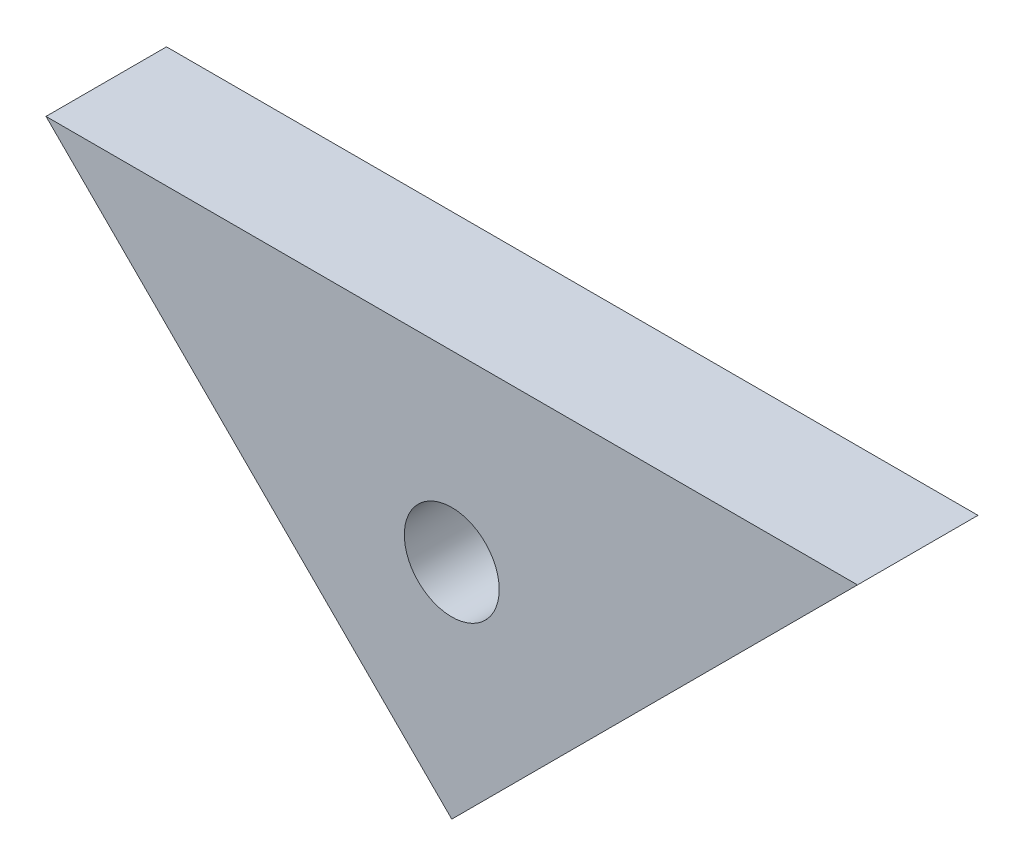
SolidWorks part; units mm, degrees
ref_plane "Front Plane" through (0, 0, 0) normal (0, 0, 1) x (1, 0, 0)
ref_plane "Top Plane" through (0, 0, 0) normal (0, 1, 0) x (1, 0, 0)
ref_plane "Right Plane" through (0, 0, 0) normal (1, 0, 0) x (0, 0, -1)
sketch "Sketch2" plane through (0, 0, 0) normal (0, 0, 1) x (1, 0, 0)
  line L0 (0, 0) -> (13.4704, 13.4704)
  line L1 (0, 0) -> (-13.4704, 13.4704)
  line L2 (-13.4704, 13.4704) -> (13.4704, 13.4704)
extrude "Boss-Extrude1" add sketch "Sketch2" along normal blind 4 contours L1 L2 L0
sketch "Sketch4" plane through (0, 0, 4) normal (0, 0, 1) x (1, 0, 0)
  line L0 (0, 0) -> (0, 14.7786) construction
  circle A0 centre (0, 7.3893) radius 1.575
  dimension "D1" = 3.15
extrude "Cut-Extrude2" cut sketch "Sketch4" against normal blind 5 contours A0
